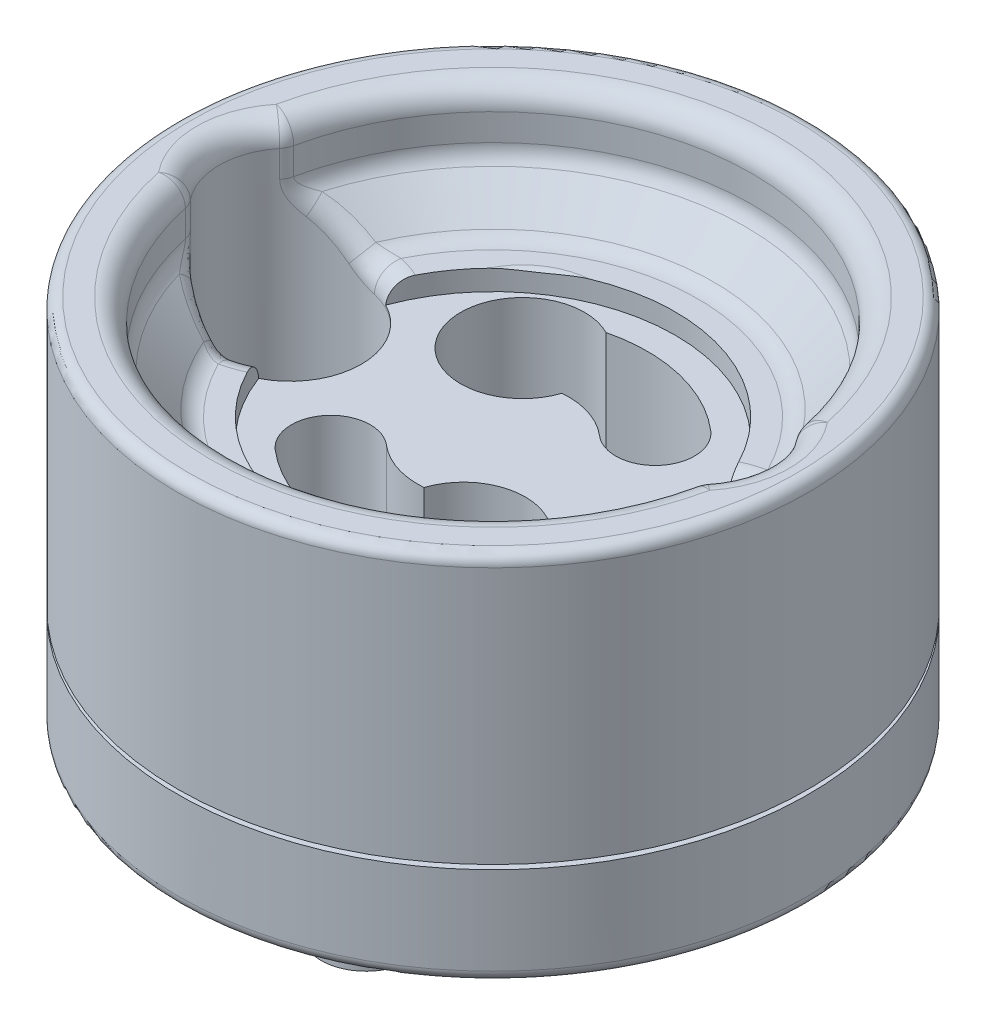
SolidWorks part; units mm, degrees
ref_plane "Płaszczyzna przednia" through (0, 0, 0) normal (0, 0, 1) x (1, 0, 0)
ref_plane "Płaszczyzna górna" through (0, 0, 0) normal (0, 1, 0) x (1, 0, 0)
ref_plane "Płaszczyzna prawa" through (0, 0, 0) normal (1, 0, 0) x (0, 0, -1)
sketch "Szkic1" plane through (0, 0, 0) normal (0, 1, 0) x (1, 0, 0)
  circle A0 centre (0, 0) radius 14
extrude "Dodanie-wyciągnięcie1" add sketch "Szkic1" along normal blind 16.5
sketch "Szkic2" plane through (0, 16.5, 0) normal (0, 1, 0) x (1, 0, 0)
  circle A0 centre (0, 0) radius 11.5
extrude "Wytnij-wyciągnięcie1" cut sketch "Szkic2" against normal blind 2.6
sketch "Szkic3" plane through (0, 13.9, 0) normal (0, 1, 0) x (1, 0, 0)
  circle A0 centre (0, 0) radius 11.5
fillet "Zaokrąglenie1" radius 0.5 1 edges at (0, 16.5, 14)
fillet "Zaokrąglenie2" radius 0.5 1 edges at (0, 0, 14)
sketch "Szkic4" plane through (0, 0, 0) normal (0, -1, 0) x (-1, 0, 0)
  line L0 (3.6697, 9.3023) -> (-3.6697, -9.3023) construction
  line L1 (0, -8.5) -> (0, 9.5) construction
  line L2 (0, -8.5) -> (0, 9.5) construction
  line L3 (-9, 0) -> (9, 0) construction
  line L4 (0, 9.5) -> (0, -8.5) construction
  circle A4 centre (9, 0) radius 1.25
  circle A5 centre (-9, 0) radius 1.25
  circle A6 centre (-3.6697, -9.3023) radius 2.5
  circle A7 centre (3.6697, 9.3023) radius 2.5
  dimension "D1" = 20
  dimension "D2" = 10
  dimension "D3" = 18
extrude "Wytnij-wyciągnięcie3" cut sketch "Szkic4" against normal blind 0.5
sketch "Szkic5" plane through (0, 13.9, 0) normal (0, -1, 0) x (1, 0, 0)
  circle A0 centre (-3.6697, -9.3023) radius 1.15
  circle A1 centre (3.6697, 9.3023) radius 1.15
  dimension "D1" = 2.3
extrude "Dodanie-wyciągnięcie3" add sketch "Szkic5" along normal blind 1 contours A0 | A1
sketch "Szkic6" plane through (0, 0, 0) normal (0, -1, 0) x (1, 0, 0)
  circle A0 centre (0, 0) radius 14
  circle A1 centre (-9, 0) radius 1.25
  circle A2 centre (9, 0) radius 1.25
  circle A3 centre (3.3028, 8.3721) radius 1.15
  circle A4 centre (3.3028, 8.3721) radius 2.5
  circle A5 centre (-3.3028, -8.3721) radius 1.15
  circle A6 centre (-3.3028, -8.3721) radius 2.5
  circle A9 centre (0, 0) radius 14 construction
  circle A10 centre (9, 0) radius 1.25 construction
  dimension "D1" = 2.3
  dimension "D2" = 5
  dimension "D3" = 2.5
  dimension "D4" = 5.6972
  dimension "D5" = 8.3721
sketch "Szkic7" plane through (0, 13.9, 0) normal (0, 1, 0) x (1, 0, 0)
  circle A0 centre (0, 0) radius 8.5
extrude "Wytnij-wyciągnięcie4" cut sketch "Szkic7" against normal blind 2
chamfer "Sfazowanie1" distance 3 angle 45 1 edges at (0, 13.9, 8.5)
sketch "Szkic8" plane through (0, 11.9, 0) normal (0, 1, 0) x (1, 0, 0)
  arc A0 (1.639, -6.653) -> (0.2796, -3.3403) centre (2.8904, -4.2042) ccw
  arc A1 (-1.639, 6.653) -> (-0.2796, 3.3403) centre (-2.8904, 4.2042) ccw
  arc A2 (-4.4659, -5.1966) -> (1.639, -6.653) centre (0, 0) ccw
  arc A3 (-2.1847, -2.5422) -> (0.2796, -3.3403) centre (0, 0) ccw
  arc A4 (-2.1847, -2.5422) -> (-4.4659, -5.1966) centre (-3.3253, -3.8694) ccw
  arc A5 (4.4659, 5.1966) -> (-1.639, 6.653) centre (0, 0) ccw
  arc A6 (2.1847, 2.5422) -> (-0.2796, 3.3403) centre (0, 0) ccw
  arc A7 (2.1847, 2.5422) -> (4.4659, 5.1966) centre (3.3253, 3.8694) ccw
  point P16 (0, 0)
  dimension "D1" = 5.5
  dimension "D2" = 2
extrude "Wytnij-wyciągnięcie5" cut sketch "Szkic8" against normal blind 8.3
sketch "Szkic10" plane through (0, 0.5, 0) normal (0, -1, 0) x (1, 0, 0)
  circle A0 centre (9, 0) radius 1.25
  circle A1 centre (-9, 0) radius 1.25
extrude "Wytnij-wyciągnięcie6" cut sketch "Szkic10" against normal blind 19.5
sketch "Szkic11" plane through (0, 16.5, 0) normal (0, 1, 0) x (1, 0, 0)
  circle A0 centre (9, 0) radius 3.15
  circle A1 centre (-9, 0) radius 3.15
extrude "Wytnij-wyciągnięcie7" cut sketch "Szkic11" against normal blind 14
fillet "Zaokrąglenie3" radius 1 2 edges at (0, 16.5, -11.5) (0, 16.5, 11.5)
fillet "Zaokrąglenie4" radius 1 14 edges at (11.296, 14.7, 2.1566) (11.296, 14.7, -2.1566) (-11.296, 14.7, -2.1566) (-11.296, 14.7, 2.1566) (-5.85, 11.9, 0) (5.85, 11.9, 0) (0, 13.9, -11.5) (0, 13.9, 11.5) (10.1951, 13.0035, -2.9145) (10.1363, 12.9535, 2.9379) (0, 11.9, 9.5) (0, 11.9, -9.5) (-10.1951, 13.0035, 2.9145) (-10.1363, 12.9535, -2.9379)
fillet "Zaokrąglenie5" radius 0.5 8 edges at (4.6525, 11.9, -2.7288) (1.59, 11.9, -6.6649) (-5.4345, 11.9, -3.1602) (1.0328, 11.9, -3.1889) (-4.6525, 11.9, 2.7288) (-1.59, 11.9, 6.6649) (5.4345, 11.9, 3.1602) (-1.0328, 11.9, 3.1889)
sketch "Szkic12" plane through (0, 0, 0) normal (0, -1, 0) x (1, 0, 0)
  circle A0 centre (-3.6697, -9.3023) radius 2
  circle A1 centre (-3.6697, -9.3023) radius 1.15
  circle A2 centre (3.6697, 9.3023) radius 2
  circle A3 centre (3.6697, 9.3023) radius 1.15
  circle A4 centre (3.6697, 9.3023) radius 2.5 construction
  circle A5 centre (-3.6697, -9.3023) radius 2.5 construction
extrude "Dodanie-wyciągnięcie4" add sketch "Szkic12" along normal blind 1.5
fillet "Zaokrąglenie6" radius 0.5 4 edges at (-9, 0, 1.25) (-3.6697, 0, -11.8023) (3.6697, 0, 6.8023) (9, 0, 1.25)
sketch "Szkic14" plane through (0, 0, 0) normal (0, 0, 1) x (1, 0, 0)
  line L1 (16.8222, 4.4) -> (-16.8222, 4.4)
  line L2 (16.8222, 4.4) -> (16.8222, 4.6)
  line L3 (16.8222, 4.6) -> (-16.8222, 4.6)
  line L4 (-16.8222, 4.4) -> (-16.8222, 4.6)
  line L5 (16.8222, 4.4) -> (-16.8222, 4.6) construction
  line L6 (16.8222, 4.6) -> (-16.8222, 4.4) construction
  point P0 (0, 4.5)
extrude "Wytnij-wyciągnięcie9" cut sketch "Szkic14" against normal through all both and the other way through all
sketch "Szkic17" plane through (0, 0, 0) normal (0, 0, 1) x (1, 0, 0)
  line L0 (0, 0) -> (0, 10.9403) construction
  line L1 (1.8429, 16.5236) -> (1.8757, 10.9044)
sketch "Szkic18" plane through (0, 16.5, 0) normal (0, 1, 0) x (1, 0, 0)
  circle A0 centre (0, 0) radius 8.0858
extrude "Wytnij-wyciągnięcie11" cut sketch "Szkic18" against normal blind 5.5
sketch "Szkic19" plane through (0, 0, 0) normal (1, 0, 0) x (0, 0, -1)
  line L0 (-0.6054, 16.5) -> (-0.6054, 11)
  line L1 (2.6134, 16.5) -> (-2.6134, 16.5) construction
  line L2 (2.817, 11) -> (-2.817, 11) construction
